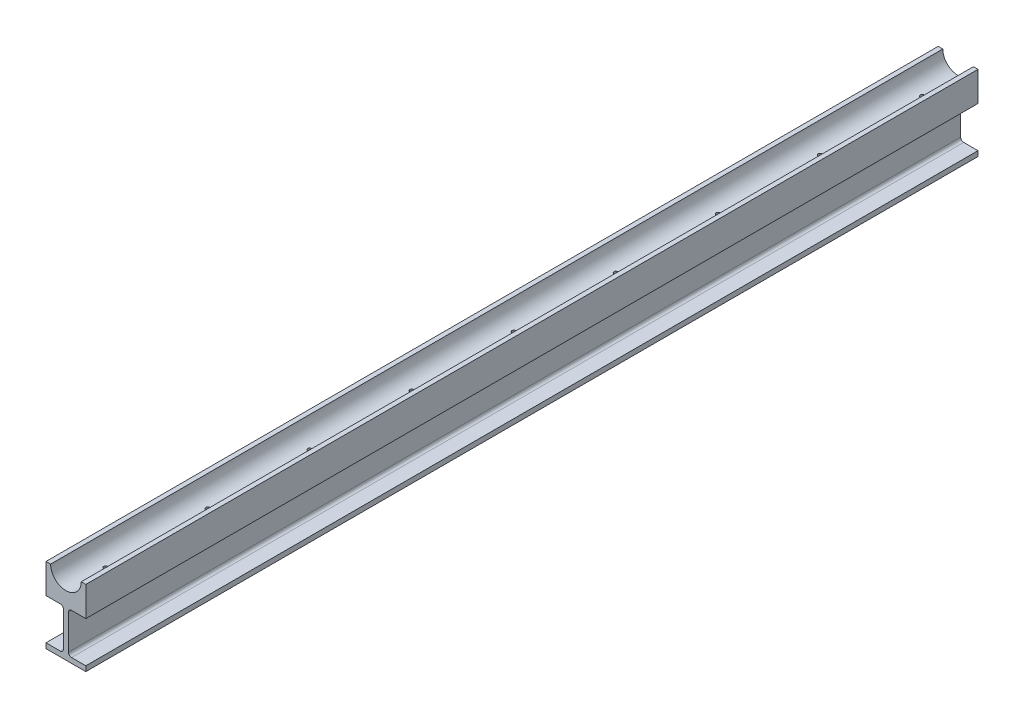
SolidWorks part; units mm, degrees
ref_plane "Face" through (0, 0, 0) normal (0, 0, 1) x (1, 0, 0)
ref_plane "Dessus" through (0, 0, 0) normal (0, 1, 0) x (1, 0, 0)
ref_plane "Droite" through (0, 0, 0) normal (1, 0, 0) x (0, 0, -1)
sketch "Esquisse1" plane through (0, 0, 0) normal (0, 0, 1) x (1, 0, 0)
  line L0 (0, 0) -> (9, 0)
  line L1 (78, 0) -> (78, -58)
  line L2 (78, -58) -> (50, -58)
  line L3 (44, -64) -> (44, -132)
  line L4 (50, -138) -> (78, -138)
  line L5 (78, -138) -> (78, -148)
  line L6 (78, -148) -> (0, -148)
  line L7 (0, -148) -> (0, -138)
  line L8 (0, -138) -> (28, -138)
  line L9 (34, -132) -> (34, -64)
  line L10 (28, -58) -> (0, -58)
  line L11 (0, -58) -> (0, 0)
  line L12 (69, 0) -> (78, 0)
  arc A0 (34, -64) -> (28, -58) centre (28, -64) ccw
  arc A1 (50, -58) -> (44, -64) centre (50, -64) ccw
  arc A2 (44, -132) -> (50, -138) centre (50, -132) ccw
  arc A3 (28, -138) -> (34, -132) centre (28, -132) ccw
  arc A4 (9, 0) -> (69, 0) centre (39, 0) ccw
  point P15 (34, -58)
  point P18 (44, -58)
  point P21 (44, -138)
  point P24 (34, -138)
  dimension "D10" = 6
  dimension "D11" = 60
  dimension "D1" = 78
  dimension "D2" = 34
  dimension "D3" = 34
  dimension "D4" = 34
  dimension "D5" = 10
  dimension "D6" = 10
  dimension "D7" = 80
  dimension "D8" = 80
  dimension "D9" = 58
  dimension "D12" = 39
extrude "Extrusion1" add sketch "Esquisse1" along normal blind 1748
hole_wizard "Trou taraudé M61" positions "Esquisse4" profile "Esquisse3" tap size "M6" standard "ISO"
sketch "Esquisse4" plane through (0, 0, 0) normal (-1, 0, 0) x (0, 0, 1)
  line L0 (0, 0) -> (0, -58) construction
  line L1 (1748, 0) -> (0, 0) construction
  point P0 (338, -36)
  point P1 (380, -36)
  point P3 (1374, -36)
  point P5 (1416, -36)
  point P8 (0, -29)
  dimension "D1" = 338
  dimension "D2" = 42
  dimension "D3" = 42
  dimension "D4" = 994
  dimension "D5" = 36
  dimension "D6" = 36
  dimension "D7" = 36
  dimension "D8" = 36
sketch "Esquisse3" plane through (0, -36, 338) normal (0, 1, 0) x (0, 0, 1)
  line L0 (0, 0) -> (0, 27.5022)
  line L1 (0, 27.5022) -> (2.5, 26)
  line L2 (2.5, 26) -> (2.5, 0)
  line L5 (2.5, 0) -> (0, 0)
  line L10 (0, 27.5022) -> (-2.5, 26) construction
  line L11 (0, -6.35) -> (0, 107.95) construction
  dimension "Diamètre du trou pour taraudage" = 5
  dimension "Profondeur du trou pour taraudage" = 26
  dimension "Angle de pointe" = 118
sketch "Esquisse5" plane through (0, 0, 0) normal (0, 1, 0) x (1, 0, 0)
  line L0 (0, -1748) -> (0, 0) construction
  line L2 (69, 0) -> (9, 0) construction
  circle A0 centre (39, -70) radius 4
  dimension "D1" = 8
  dimension "D2" = 39
  dimension "D3" = 70
extrude "Enlèv. mat.-Extru.1" cut sketch "Esquisse5" against normal blind 40
pattern_linear "Répétition linéaire1" count 9 spacing 200 along (0, 0, 1) of "Enlèv. mat.-Extru.1"
